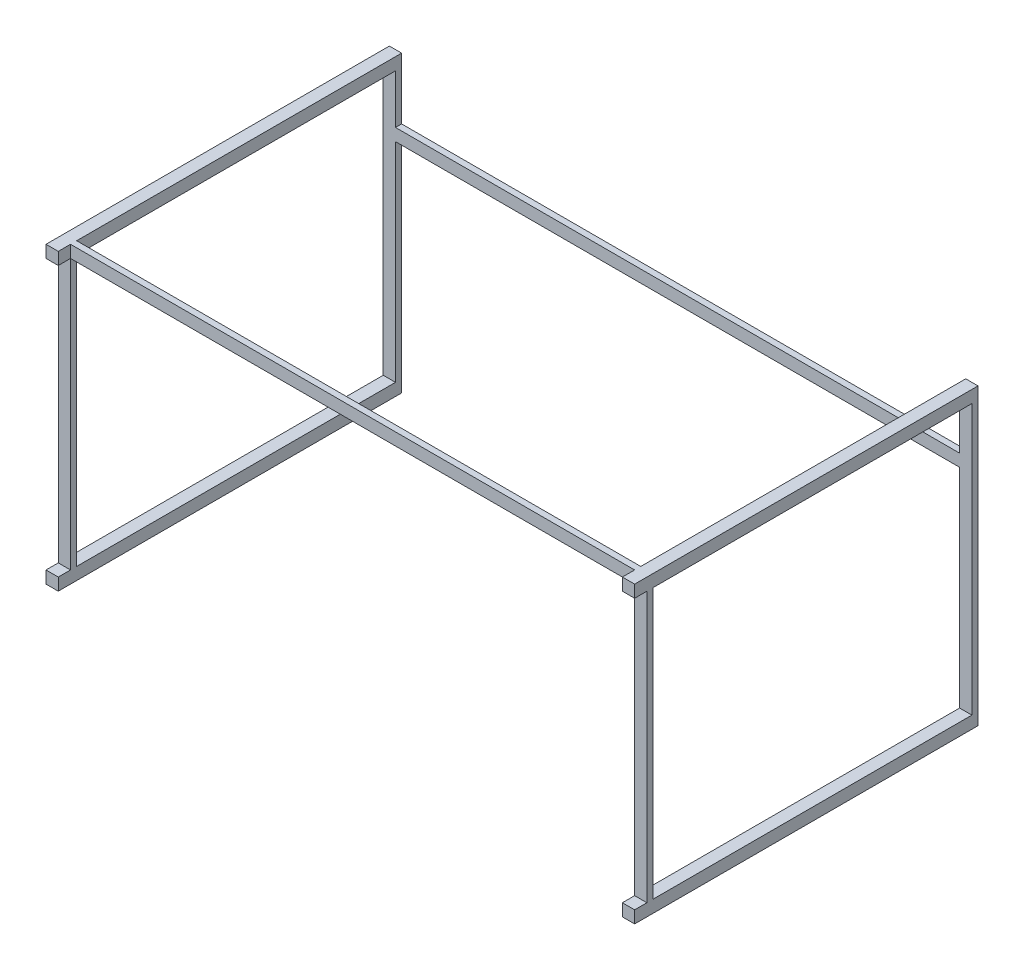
SolidWorks part; units mm, degrees
ref_plane "Front Plane" through (0, 0, 0) normal (0, 0, 1) x (1, 0, 0)
ref_plane "Top Plane" through (0, 0, 0) normal (0, 1, 0) x (1, 0, 0)
ref_plane "Right Plane" through (0, 0, 0) normal (1, 0, 0) x (0, 0, -1)
sketch "Sketch1" plane through (0, 0, 0) normal (0, 0, 1) x (1, 0, 0)
  line L1 (0, 0) -> (25.4, 0)
  line L2 (0, 0) -> (0, 25.4)
  line L3 (0, 25.4) -> (25.4, 25.4)
  line L4 (25.4, 0) -> (25.4, 25.4)
  dimension "D1" = 25.4
extrude "Boss-Extrude1" add sketch "Sketch1" against normal blind 711.2
sketch "Sketch3" plane through (0, 0, 0) normal (0, -1, 0) x (1, 0, 0)
  line L0 (0, -711.2) -> (0, 0) construction
  line L1 (0, -25.4) -> (25.4, -25.4)
  line L2 (0, -25.4) -> (0, -38.1)
  line L3 (0, -38.1) -> (25.4, -38.1)
  line L4 (25.4, -25.4) -> (25.4, -38.1)
  line L5 (25.4, -711.2) -> (25.4, 0) construction
  line L6 (0, 0) -> (25.4, 0) construction
  dimension "D1" = 25.4
  dimension "D2" = 12.7
extrude "Boss-Extrude2" add sketch "Sketch3" along normal blind 558.8
sketch "Sketch4" plane through (0, 0, -25.4) normal (0, 0, 1) x (1, 0, 0)
  line L1 (0, -558.8) -> (25.4, -558.8)
  line L2 (0, -558.8) -> (0, -584.2)
  line L3 (0, -584.2) -> (25.4, -584.2)
  line L4 (25.4, -558.8) -> (25.4, -584.2)
extrude "Boss-Extrude3" add sketch "Sketch4" against normal blind 685.8 and the other way blind 25.4
sketch "Sketch6" plane through (25.4, 0, 0) normal (1, 0, 0) x (0, 0, -1)
  line L0 (711.2, 25.4) -> (0, 25.4) construction
  line L1 (25.4, 0) -> (38.1, 0)
  line L2 (25.4, 0) -> (25.4, 25.4)
  line L3 (25.4, 25.4) -> (38.1, 25.4)
  line L4 (38.1, 0) -> (38.1, 25.4)
extrude "Boss-Extrude4" add sketch "Sketch6" along normal blind 584.2
ref_plane "Plane1" through (609.6, 0, 0) normal (1, 0, 0) x (0, 0, -1)
mirror "Mirror2" about plane through (609.6, 0, 0) normal (1, 0, 0) of "Boss-Extrude1", "Boss-Extrude2", "Boss-Extrude3", "Boss-Extrude4"
mirror "Mirror3" about plane through (609.6, 0, 0) normal (1, 0, 0) of "Boss-Extrude2", "Boss-Extrude3", "Boss-Extrude1"
sketch "Sketch10" plane through (0, 0, 0) normal (0, -1, 0) x (1, 0, 0)
  line L0 (25.4, -711.2) -> (25.4, -38.1) construction
  line L1 (0, -711.2) -> (25.4, -711.2)
  line L2 (0, -711.2) -> (0, -698.5)
  line L3 (0, -698.5) -> (25.4, -698.5)
  line L4 (25.4, -711.2) -> (25.4, -698.5)
  dimension "D1" = 12.7
extrude "Boss-Extrude6" add sketch "Sketch10" along normal up to next
sketch "Sketch12" plane through (25.4, 0, 0) normal (1, 0, 0) x (0, 0, -1)
  line L1 (698.5, 0) -> (711.2, 0)
  line L2 (698.5, 0) -> (698.5, 25.4)
  line L3 (698.5, 25.4) -> (711.2, 25.4)
  line L4 (711.2, 0) -> (711.2, 25.4)
mirror "Mirror4" about plane through (609.6, 0, 0) normal (1, 0, 0) of "Boss-Extrude6"
sketch "Sketch13" plane through (25.4, 0, 0) normal (1, 0, 0) x (0, 0, -1)
  line L0 (698.5, -558.8) -> (698.5, 0) construction
  line L1 (698.5, -127) -> (711.2, -127)
  line L2 (698.5, -127) -> (698.5, -101.6)
  line L3 (698.5, -101.6) -> (711.2, -101.6)
  line L4 (711.2, -127) -> (711.2, -101.6)
  line L5 (711.2, -584.2) -> (711.2, 25.4) construction
  line L6 (698.5, 25.4) -> (711.2, 25.4) construction
  dimension "D1" = 25.4
  dimension "D2" = 127
extrude "Boss-Extrude7" add sketch "Sketch13" along normal up to next
